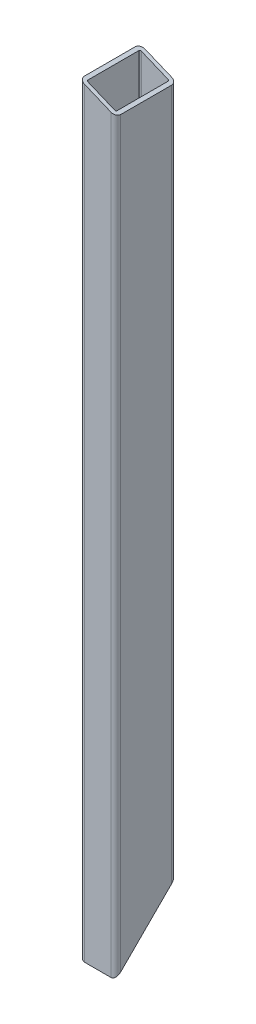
SolidWorks part; units mm, degrees
ref_plane "Plan de face" through (0, 0, 0) normal (0, 0, 1) x (1, 0, 0)
ref_plane "Plan de dessus" through (0, 0, 0) normal (0, 1, 0) x (1, 0, 0)
ref_plane "Plan de droite" through (0, 0, 0) normal (1, 0, 0) x (0, 0, -1)
imported_body "Importée3"
fillet "Congé1" radius 1
fillet "Congé2" radius 4 4 edges at (-15, 339.4, -25) (15, 308.1868, 25) (-15, 314.4, 25) (15, 333.1868, -25)
